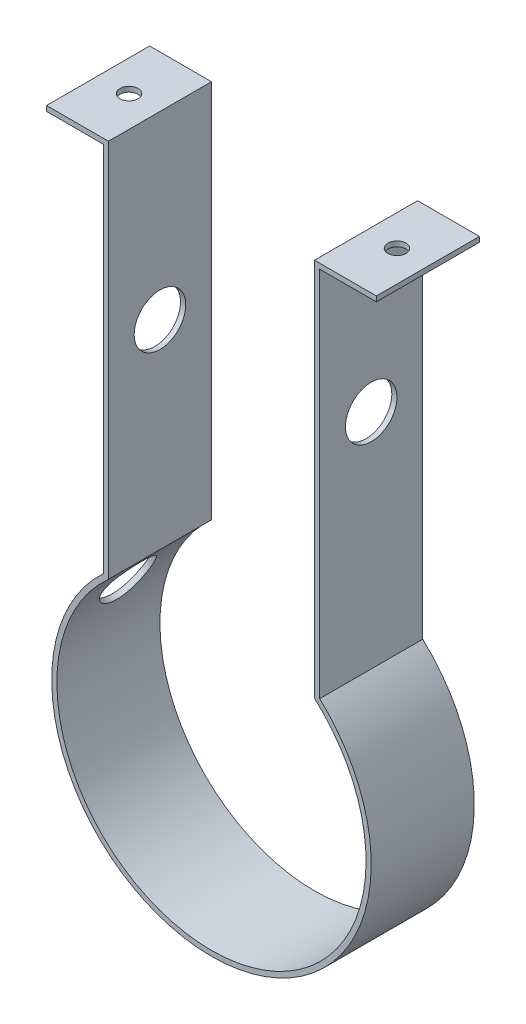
SolidWorks part; units mm, degrees
ref_plane "Front Plane" through (0, 0, 0) normal (0, 0, 1) x (1, 0, 0)
ref_plane "Top Plane" through (0, 0, 0) normal (0, 1, 0) x (1, 0, 0)
ref_plane "Right Plane" through (0, 0, 0) normal (1, 0, 0) x (0, 0, -1)
sketch "Sketch1" plane through (0, 0, 0) normal (0, 0, 1) x (1, 0, 0)
  line L0 (0, -30) -> (0, 183.177) construction
  line L1 (-20, 22.3607) -> (-20, 96)
  line L2 (-20, 96) -> (-32, 96)
  line L3 (20, 22.3607) -> (20, 96)
  line L4 (20, 96) -> (32, 96)
  line L5 (-21, 95) -> (-32, 95)
  line L6 (-21, 22.8035) -> (-21, 95)
  line L7 (21, 22.8035) -> (21, 95)
  line L8 (21, 95) -> (32, 95)
  line L9 (32, 96) -> (32, 95)
  line L10 (-32, 96) -> (-32, 95)
  arc A0 (-20, 22.3607) -> (20, 22.3607) centre (0, 0) ccw
  arc A1 (-21, 22.8035) -> (21, 22.8035) centre (0, 0) ccw
  dimension "D2" = 30
  dimension "D1" = 20
  dimension "D3" = 96
  dimension "D4" = 64
  dimension "D5" = 1
extrude "Extrude1" add sketch "Sketch1" along normal blind 20
sketch "Sketch2" plane through (0, 96, 0) normal (0, 1, 0) x (1, 0, 0)
  line L0 (32, -10) -> (-32, -10) construction
  line L1 (32, -20) -> (32, 0) construction
  line L2 (-32, -20) -> (-32, 0) construction
  line L3 (0, 0) -> (0, -20) construction
  line L4 (-30, -20) -> (30, -20) construction
  circle A0 centre (26, -10) radius 1.75
  circle A1 centre (-26, -10) radius 1.75
  dimension "D1" = 3.5
  dimension "D2" = 52
  dimension "D3" = 26
extrude "Extrude2" cut sketch "Sketch2" against normal blind 20
sketch "Sketch3" plane through (21, 0, 0) normal (1, 0, 0) x (0, 0, -1)
  line L0 (-10, 22.8035) -> (-10, 102.8127) construction
  line L1 (-20, 22.8035) -> (0, 22.8035) construction
  line L2 (-20, 96) -> (0, 96) construction
  circle A0 centre (-10, 66) radius 5
  dimension "D1" = 10
  dimension "D2" = 30
extrude "Extrude3" cut sketch "Sketch3" against normal blind 20
sketch "Sketch4" plane through (-21, 0, 0) normal (-1, 0, 0) x (0, 0, 1)
  line L0 (10, 22.8035) -> (10, 95) construction
  line L1 (20, 22.8035) -> (0, 22.8035) construction
  line L2 (20, 95) -> (0, 95) construction
  line L3 (20, 96) -> (0, 96) construction
  circle A0 centre (10, 61) radius 5
  dimension "D1" = 10
  dimension "D2" = 35
extrude "Extrude4" cut sketch "Sketch4" against normal blind 20
sketch "Sketch5" plane through (0, 0, 0) normal (0, 0, 1) x (1, 0, 0)
  line L0 (0, 0) -> (-40.5465, 22.2852) construction
  circle A0 centre (-21, 22.8035) radius 10
  circle A1 centre (0, 0) radius 31
  dimension "D1" = 20
  dimension "D2" = 62
ref_plane "Plane1" through (-40.5465, 22.2852, 0) normal (-0.8764, 0.4817, 0) x (0, 0, 1)
sketch "Sketch6" plane through (-40.5465, 22.2852, 0) normal (-0.8764, 0.4817, 0) x (0, 0, 1)
  line L0 (10, 9.8691) -> (10, -31) construction
  line L1 (20, 9.8691) -> (0, 9.8691) construction
  line L2 (0, -31) -> (20, -31) construction
  line L3 (0, 0) -> (32.4994, 0) construction
  circle A0 centre (10, 0) radius 5
  dimension "D1" = 10
extrude "Extrude5" cut sketch "Sketch6" against normal blind 20
